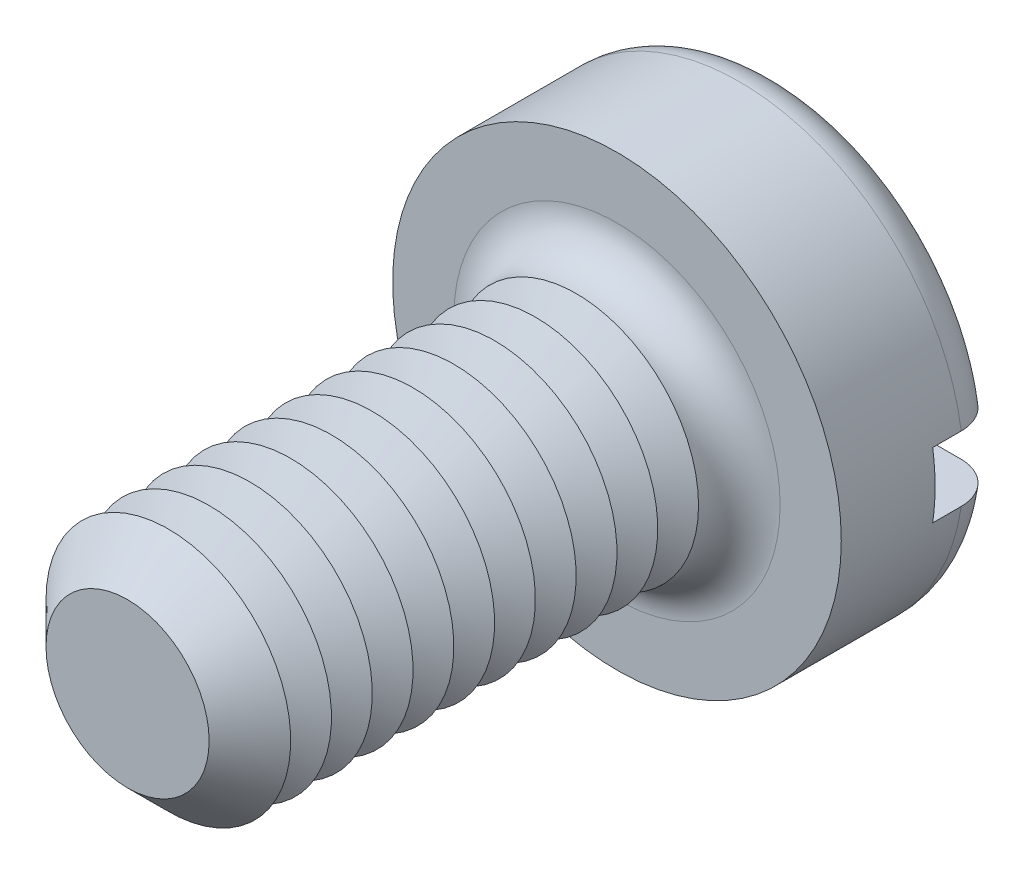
SolidWorks part; units mm, degrees
ref_plane "Front Plane" through (0, 0, 0) normal (0, 0, 1) x (1, 0, 0)
ref_plane "Top Plane" through (0, 0, 0) normal (0, 1, 0) x (1, 0, 0)
ref_plane "Right Plane" through (0, 0, 0) normal (1, 0, 0) x (0, 0, -1)
sketch "Sketch3" plane through (0, 0, 0) normal (0, 0, 1) x (1, 0, 0)
  circle A0 centre (0, 0) radius 2.75
  dimension "D1" = 5.5
extrude "Boss-Extrude2" add sketch "Sketch3" against normal blind 2
sketch "Sketch4" plane through (0, 0, 0) normal (0, 0, 1) x (1, 0, 0)
  circle A0 centre (0, 0) radius 1.5
  dimension "D1" = 3
extrude "Boss-Extrude3" add sketch "Sketch4" along normal blind 6
fillet "Fillet1" radius 0.5 2 edges at (2.75, 0, -2) (1.5, 0, 0)
chamfer "Chamfer1" distance 0.5 angle 45 1 edges at (1.5, 0, 6)
sketch "Sketch5" plane through (0, 0, 0) normal (1, 0, 0) x (0, 0, -1)
  line L0 (1.6944, 0) -> (-7.6738, 0) construction
sketch "Sketch6" plane through (0, 0, 0) normal (1, 0, 0) x (0, 0, -1)
  line L0 (-0.5, 1.5) -> (-0.75, 1.067)
  line L1 (-0.75, 1.067) -> (-1, 1.5)
  line L2 (-0.5, 1.5) -> (-5.5, 1.5) construction
  line L3 (-1, 1.5) -> (-0.5, 1.5)
  dimension "D1" = 0.5
revolve "Cut-Revolve1" cut sketch "Sketch6" angle 360 about L0
pattern_linear "LPattern1" count 10 spacing 0.5 along (0, 0, 1) of "Cut-Revolve1"
sketch "Sketch8" plane through (0, 0, -2) normal (0, 0, -1) x (-1, 0, 0)
  line L1 (2.75, -0.4) -> (-2.75, -0.4)
  line L2 (2.75, -0.4) -> (2.75, 0.4)
  line L3 (2.75, 0.4) -> (-2.75, 0.4)
  line L4 (-2.75, -0.4) -> (-2.75, 0.4)
  line L5 (2.75, -0.4) -> (-2.75, 0.4) construction
  line L6 (2.75, 0.4) -> (-2.75, -0.4) construction
  point P0 (0, 0)
  dimension "D1" = 5.5
  dimension "D2" = 0.8
extrude "Cut-Extrude1" cut sketch "Sketch8" against normal blind 0.85
